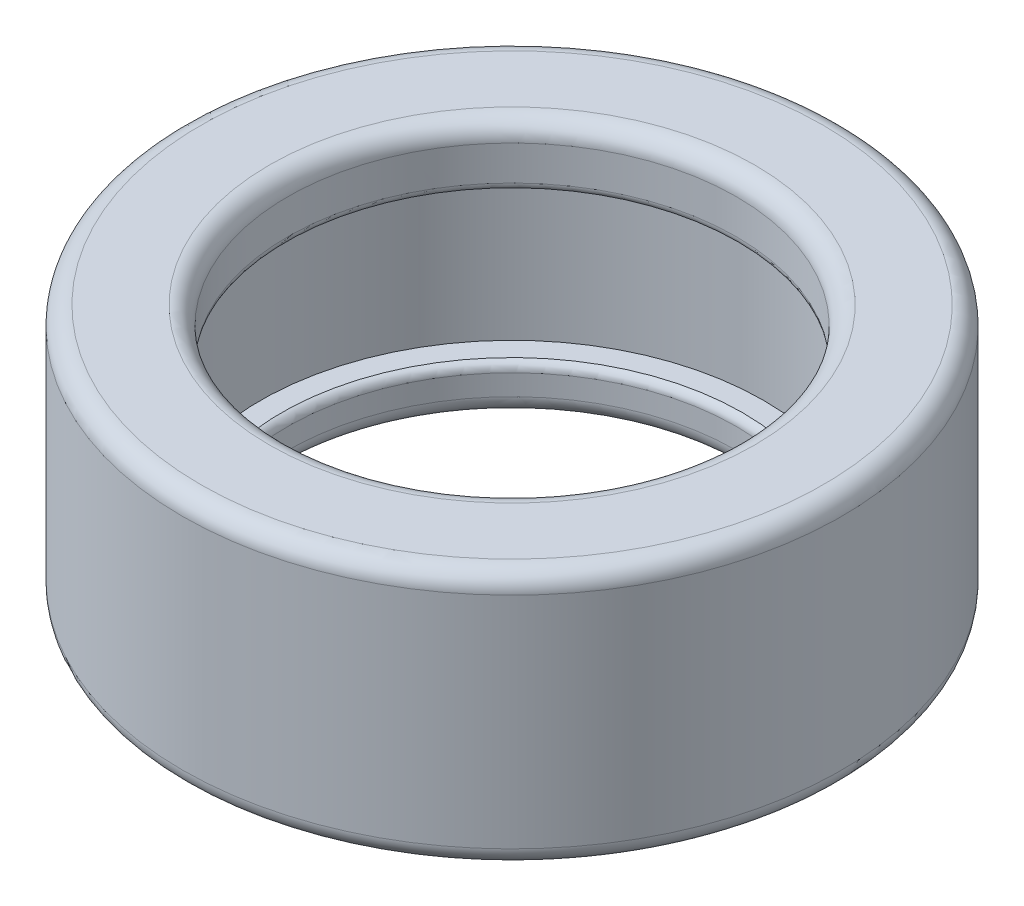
SolidWorks part; units mm, degrees
ref_plane "Front Plane" through (0, 0, 0) normal (0, 0, 1) x (1, 0, 0)
ref_plane "Top Plane" through (0, 0, 0) normal (0, 1, 0) x (1, 0, 0)
ref_plane "Right Plane" through (0, 0, 0) normal (1, 0, 0) x (0, 0, -1)
sketch "Sketch1" plane through (0, 0, 0) normal (0, 1, 0) x (1, 0, 0)
  line L0 (0, -38.8562) -> (0, 37.4816) construction
  line L1 (0, 37.4816) -> (-45.5794, 0) construction
  line L2 (-45.5794, 0) -> (43.3009, 0) construction
  circle A0 centre (0, 0) radius 18
  point P7 (0, 0)
  dimension "D1" = 36
extrude "Boss-Extrude1" add sketch "Sketch1" along normal blind 14
other "Cavity2"
other "roata MBTaxi 118<2>@Roata MBTaxi1"
sketch "Sketch2" plane through (0, 0, 0) normal (0, -1, 0) x (1, 0, 0)
  circle A0 centre (0, 0) radius 12.25 construction
  circle A1 centre (0, 0) radius 12.25
extrude "Cut-Extrude1" cut sketch "Sketch2" against normal blind 14
fillet "Fillet1" radius 1 2 edges at (0, 14, 18) (0, 0, 18)
fillet "Fillet2" radius 1 2 edges at (0, 14, -12.25) (0, 0, -12.25)
ref_plane "Plane1" through (0, 7, 0) normal (0, 1, 0) x (1, 0, 0)
sketch "Sketch3" plane through (0, 7, 0) normal (0, 1, 0) x (1, 0, 0)
  arc A0 (-10.0715, -9.361) -> (10.045, -9.3894) centre (0, 0) ccw construction
  arc A1 (-10.0715, -9.361) -> (13.1426, -4.0416) centre (0, 0) ccw
  arc A2 (13.1426, -4.0416) -> (3.109, 13.3939) centre (0, 0) ccw construction
  arc A3 (13.1426, -4.0416) -> (3.109, 13.3939) centre (0, 0) ccw
  arc A4 (-3.0711, 13.4026) -> (-13.154, -4.0045) centre (0, 0) ccw construction
  arc A5 (3.109, 13.3939) -> (-10.0715, -9.361) centre (0, 0) ccw
extrude "Cut-Extrude2" cut sketch "Sketch3" along normal up to vertex and the other way up to vertex
